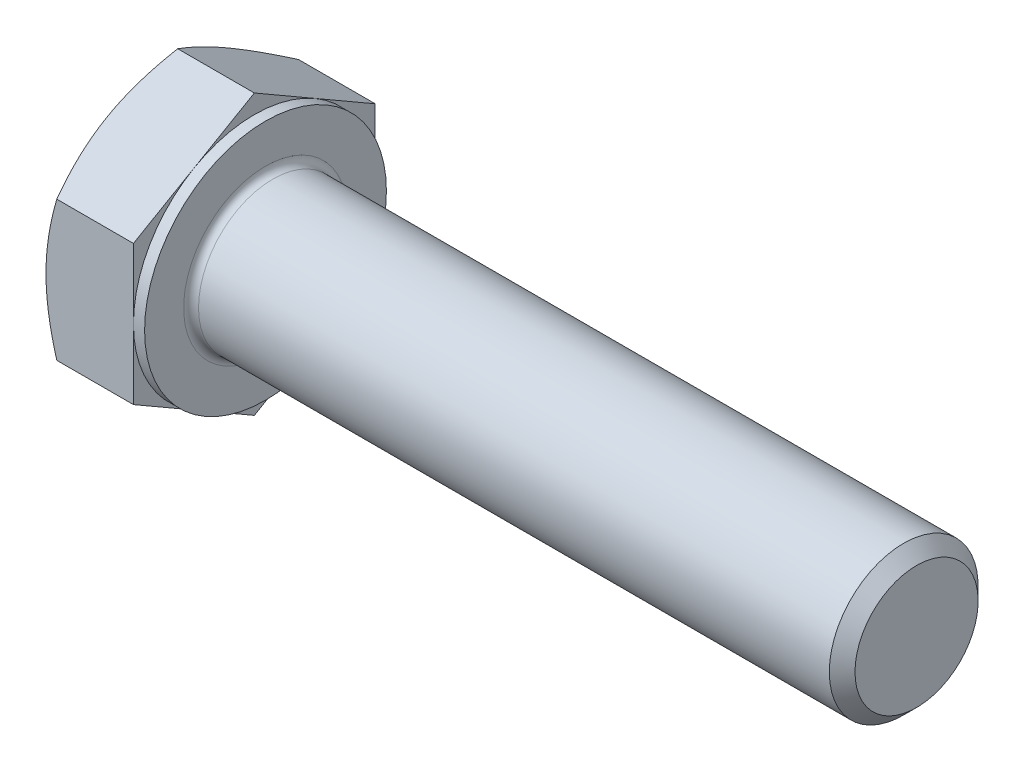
SolidWorks part; units mm, degrees
ref_plane "Plane1" through (0, 0, 0) normal (0, 0, 1) x (1, 0, 0)
ref_plane "Plane2" through (0, 0, 0) normal (0, 1, 0) x (1, 0, 0)
ref_plane "Plane3" through (0, 0, 0) normal (1, 0, 0) x (0, 0, -1)
sketch "Sketch1" plane through (0, 0, 0) normal (1, 0, 0) x (0, 0, -1)
  line L0 (6.5, 3.7528) -> (6.5, -3.7528)
  line L1 (-6.5, 3.7528) -> (-6.5, -3.7528)
  line L2 (6.5, -3.7528) -> (0, -7.5056)
  line L3 (0, -7.5056) -> (-6.5, -3.7528)
  line L4 (6.5, 3.7528) -> (0, 7.5056)
  line L5 (0, 7.5056) -> (-6.5, 3.7528)
  dimension "Width_flats" = 13
  dimension "D2" = 120
  dimension "D3" = 6.5
  dimension "D4" = 6.5
  dimension "D5" = 6.5
extrude "BaseHead" add sketch "Sketch1" along normal blind 5.3
sketch "BodySke" plane through (0, 0, 0) normal (0, 0, 1) x (1, 0, 0)
  line L0 (0, 3.7528) -> (0, -3.7528) construction
  line L1 (0, 0) -> (40.3, 0)
  line L2 (0, 0) -> (0, 4)
  line L3 (0, 4) -> (39.6095, 4)
  line L4 (40.3, 0) -> (40.3, 3.3095)
  line L5 (5.3, 7.5056) -> (5.3, 3.7528) construction
  line L6 (40.3, 3.3095) -> (39.6095, 4)
  line L7 (0, 0) -> (96.52, 0) construction
  line L8 (40.3, -3.3095) -> (39.6095, -4) construction
  line L9 (0, -4) -> (39.6095, -4) construction
  line L10 (6.55, 15.24) -> (6.55, -1.27) construction
  line L12 (5.3, 3.7528) -> (5.3, -3.7528) construction
  dimension "Length" = 35
  dimension "Body_ch_ang" = 45
  dimension "Diameter" = 8
  dimension "Minor_dia" = 6.619
  dimension "Advance" = 1.25
revolve "BaseBody" add sketch "BodySke"
fillet "HeadFillet" radius 0.4 1 edges at (5.3, 0, -4)
sketch "Sketch3" plane through (0, 0, 0) normal (0, 0, 1) x (1, 0, 0)
  line L0 (0, 6.5) -> (3.4673, 12.5056)
  line L1 (0, 7.5056) -> (0, 3.7528) construction
  line L2 (3.4673, 12.5056) -> (3.4673, 17.5056)
  line L3 (3.4673, 17.5056) -> (-10, 17.5056)
  line L4 (-10, 17.5056) -> (-10, 6.5)
  line L5 (-10, 6.5) -> (0, 6.5)
  line L6 (0, 0) -> (99.06, 0) construction
  line L7 (5.3, 7.5056) -> (0, 7.5056) construction
  dimension "D1" = 6.5
  dimension "D2" = 5
  dimension "D3" = 10
  dimension "D4" = 5
  dimension "Head_ch_ang" = 30
revolve "HeadChamfer" cut sketch "Sketch3" angle 360 about L6
sketch "Sketch4" plane through (0, 0, 0) normal (0, 0, 1) x (1, 0, 0)
  line L1 (5.3, 7.5056) -> (5.3, 3.7528) construction
  line L2 (5.3, 6.5) -> (4.7, 6.5)
  line L3 (5.3, 6.5) -> (5.3, 17.5056)
  line L4 (5.3, 17.5056) -> (4.7, 17.5056)
  line L5 (0, 0) -> (95.25, 0) construction
  line L6 (0, 0) -> (96.52, 0) construction
  line L7 (4.7, 6.5) -> (4.7, 17.5056)
  line L8 (5.3, 7.5056) -> (0.5806, 7.5056) construction
  dimension "D1" = 13
  dimension "D2" = 10
  dimension "Bearing_ht" = 0.6
revolve "BearingFace" cut sketch "Sketch4" angle 360 about L5
sketch "ThdSchSke" plane through (0, 0, 0) normal (0, 0, 1) x (1, 0, 0)
  line L0 (6.55, -3.3095) -> (6.0665, -4)
  line L1 (6.55, -3.3095) -> (7.0335, -4)
  line L2 (7.0335, -4) -> (7.0335, -5)
  line L3 (-3.175, 0) -> (5.1513, 0) construction
  line L5 (7.0335, -5) -> (6.0665, -5)
  line L6 (6.0665, -5) -> (6.0665, -4)
  dimension "Thread_minor" = 6.619
  dimension "Diameter" = 8
  dimension "Start" = 6.55
  dimension "SideAngle" = 55
  dimension "VeeAngle" = 70
  dimension "Overcut" = 10
revolve "ThreadSchematic" [suppressed] cut sketch "ThdSchSke" angle 360 about L3
pattern_linear "ThdSchPat" [suppressed]
equation "\"D3@Sketch1\" = \"Width_flats@Sketch1\" / 2"
equation "\"D4@Sketch1\" = \"D3@Sketch1\""
equation "\"D5@Sketch1\" = \"D4@Sketch1\""
equation "\"Thread_minor@ThreadCosmetic\" = \"Minor_dia@BodySke\""
equation "\"D1@Sketch3\" = \"Width_flats@Sketch1\" / 2"
equation "\"D1@Sketch4\" = \"Width_flats@Sketch1\""
equation "\"Thread_length@ThreadCosmetic\" = \"Length@BodySke\" - \"Advance@BodySke\""
equation "\"Thread_minor@ThdSchSke\" = \"Minor_dia@BodySke\""
equation "\"Diameter@ThdSchSke\" = \"Diameter@BodySke\""
equation "\"Overcut@ThdSchSke\" = \"Diameter@BodySke\" * 1.25"
equation "\"Start@ThdSchSke\" = \"Head_ht@BaseHead\" + \"Length@BodySke\" - \"Thread_length@ThreadCosmetic\"  '---Non-countersunk---"
equation "\"Num_threads@ThdSchPat\" = int( \"Thread_length@ThreadCosmetic\" / \"Advance@BodySke\" + 0.999 )  + 1"
equation "\"Advance@ThdSchPat\" = \"Thread_length@ThreadCosmetic\" /  (\"Num_threads@ThdSchPat\" - 1) 'relax it"
equation "\"Num_threads@ThdSchPat\" = \"Num_threads@ThdSchPat\" - sgn( \"Num_threads@ThdSchPat\" - 1) '---chamfered tips only---"
